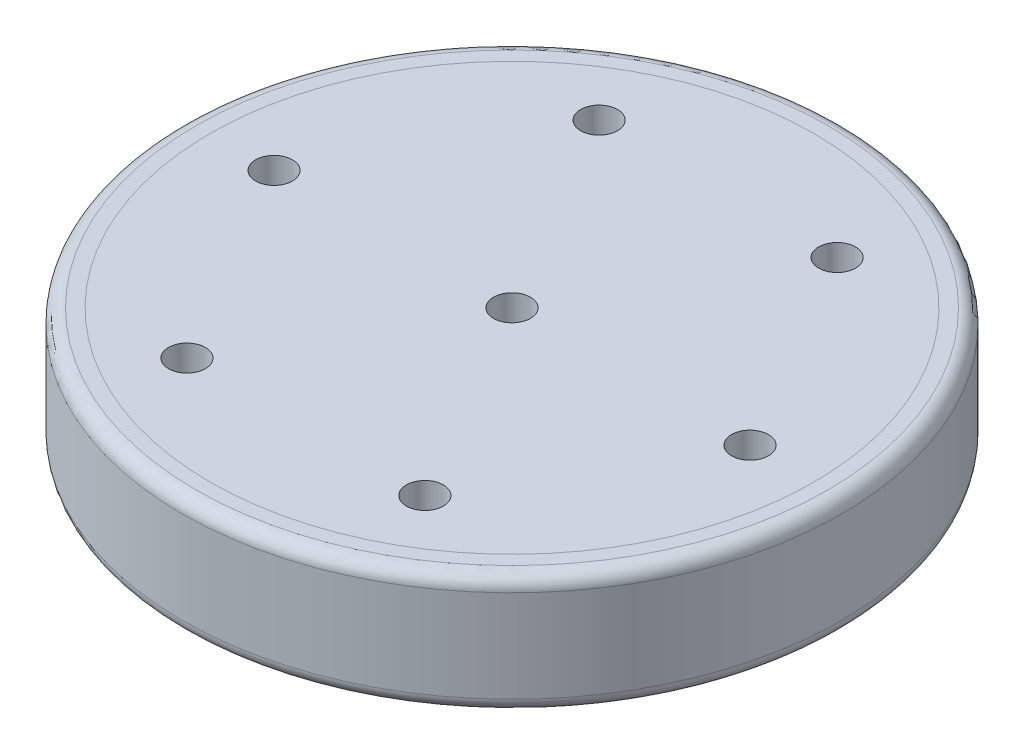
SolidWorks part; units mm, degrees
ref_plane "Alzado" through (0, 0, 0) normal (0, 0, 1) x (1, 0, 0)
ref_plane "Planta" through (0, 0, 0) normal (0, 1, 0) x (1, 0, 0)
ref_plane "Vista lateral" through (0, 0, 0) normal (1, 0, 0) x (0, 0, -1)
sketch "Croquis1" plane through (0, 0, 0) normal (0, 1, 0) x (1, 0, 0)
  circle A0 centre (0, 0) radius 32.75
  dimension "D1" = 65.5
extrude "Saliente-Extruir1" add sketch "Croquis1" along normal blind 3
sketch "Croquis2" plane through (0, 3, 0) normal (0, 1, 0) x (1, 0, 0)
  circle A0 centre (0, 0) radius 2
extrude "Cortar-Extruir1" cut sketch "Croquis2" against normal blind 4
sketch "Croquis7" plane through (0, 3, 0) normal (0, 1, 0) x (1, 0, 0)
  line L2 (25.8141, 0) -> (12.907, 22.3556)
  line L3 (12.907, 22.3556) -> (-12.907, 22.3556)
  line L4 (-12.907, 22.3556) -> (-25.8141, 0)
  line L5 (-25.8141, 0) -> (-12.907, -22.3556)
  line L6 (-12.907, -22.3556) -> (12.907, -22.3556)
  line L7 (12.907, -22.3556) -> (25.8141, 0)
  circle A0 centre (25.8141, 0) radius 2
  circle A4 centre (-25.8141, 0) radius 2
  circle A5 centre (0, 0) radius 22.3556 construction
  circle A6 centre (12.907, 22.3556) radius 2
  circle A7 centre (-12.907, -22.3556) radius 2
  circle A8 centre (-12.907, 22.3556) radius 2
  circle A9 centre (12.907, -22.3556) radius 2
extrude "Cortar-Extruir4" cut sketch "Croquis7" against normal blind 10 contours A8 L4 L3 | A4 L4 L5 | A4 L5 L4 | A8 L3 L4 | L2 A6 L3 | L3 A6 L2 | L7 A0 L2 | L2 A0 L7 | A7 L5 L6 | A7 L6 L5 | L6 A9 L7 | L7 A9 L6
sketch "Croquis8" plane through (0, 3, 0) normal (0, 1, 0) x (1, 0, 0)
  circle A0 centre (0, 0) radius 32.75
  circle A1 centre (0, 0) radius 35.75
extrude "Saliente-Extruir2" add sketch "Croquis8" against normal blind 13 separate body
fillet "Redondeo1" radius 1.5 3 edges at (0, -10, 32.75) (0, -10, 35.75) (0, 3, 35.75)
